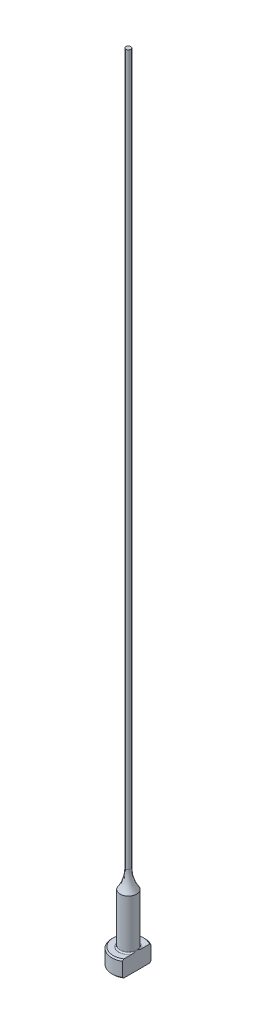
SolidWorks part; units mm, degrees
ref_plane "Front Plane" through (0, 0, 0) normal (0, 0, 1) x (1, 0, 0)
ref_plane "Top Plane" through (0, 0, 0) normal (0, 1, 0) x (1, 0, 0)
ref_plane "Right Plane" through (0, 0, 0) normal (1, 0, 0) x (0, 0, -1)
sketch "Sketch1" plane through (0, 0, 0) normal (0, 0, 1) x (1, 0, 0)
  line L0 (0, 259.9588) -> (0, -15.1925) construction
  line L1 (0, 0) -> (-3.175, 0)
  line L2 (-3.175, 0) -> (-3.175, 3.175)
  line L3 (-3.175, 3.175) -> (-1.5875, 3.175)
  line L4 (-0.4597, 16.3126) -> (-0.4597, 152.4)
  line L5 (-0.4597, 152.4) -> (0, 152.4)
  line L6 (0, 152.4) -> (0, 0)
  line L7 (-1.5875, 3.175) -> (-1.5875, 12.7)
  arc A0 (-1.5875, 12.7) -> (-0.4597, 16.3126) centre (-6.8097, 16.3126) ccw
  point P13 (-1.5875, 0)
  dimension "D1" = 6.35
  dimension "L" = 152.4
  dimension "D2" = 3.175
  dimension "H" = 6.35
  dimension "T" = 3.175
  dimension "D" = 0.9195
  dimension "S" = 12.7
revolve "Revolve1" add sketch "Sketch1" angle 360 about L0
chamfer "Chamfer1" distance 0.254 angle 45 2 edges at (0, 3.175, 3.175) (0, 0, 3.175)
fillet "Fillet1" radius 0.254 1 edges at (0, 3.175, 1.5875)
sketch "Sketch2" plane through (0, 0, 0) normal (0, 1, 0) x (1, 0, 0)
  line L0 (1.5875, -2.7496) -> (1.5875, 2.7496)
  circle A0 centre (0, 0) radius 3.175 construction
  arc A2 (1.5875, -2.7496) -> (1.5875, 2.7496) centre (0, 0) ccw
  circle A3 centre (0, 0) radius 3.175 construction
  circle A4 centre (0, 0) radius 1.5875 construction
extrude "Key Head" cut sketch "Sketch2" along normal up to next
